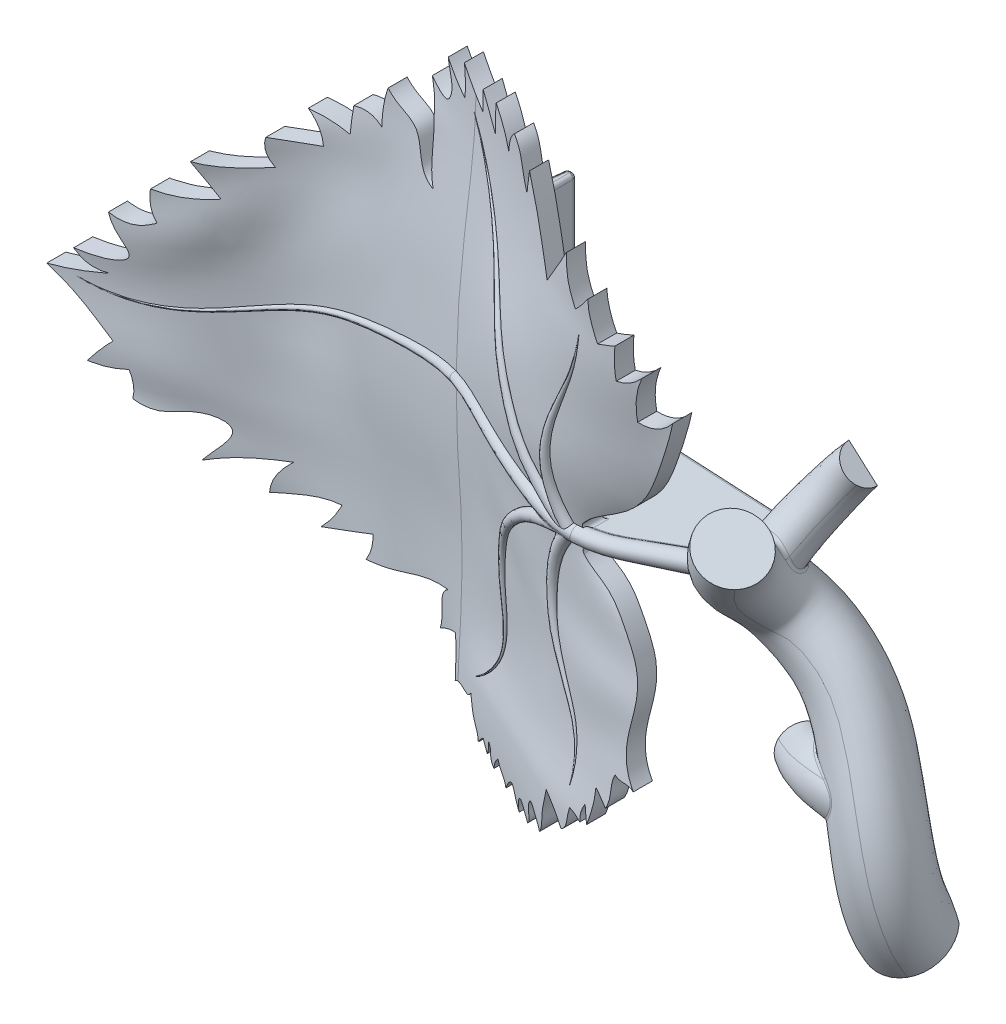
SolidWorks part; units mm, degrees
ref_plane "Plan de face" through (0, 0, 0) normal (0, 0, 1) x (1, 0, 0)
ref_plane "Plan de dessus" through (0, 0, 0) normal (0, 1, 0) x (1, 0, 0)
ref_plane "Plan de droite" through (0, 0, 0) normal (1, 0, 0) x (0, 0, -1)
imported_body "Importée3"
fillet "Congé1" radius 1
fillet "Congé3" radius 0.5 2 edges at (40.2469, -2.0724, 6.24) (40.619, -1.8003, 7.1419)
fillet "Congé4" radius 0.5 4 edges at (44.3357, -1.9184, 6.5888) (43.4859, -0.8972, 8.082) (41.8499, -0.8799, 7.9553) (35.8603, -0.2607, 6.7831)
